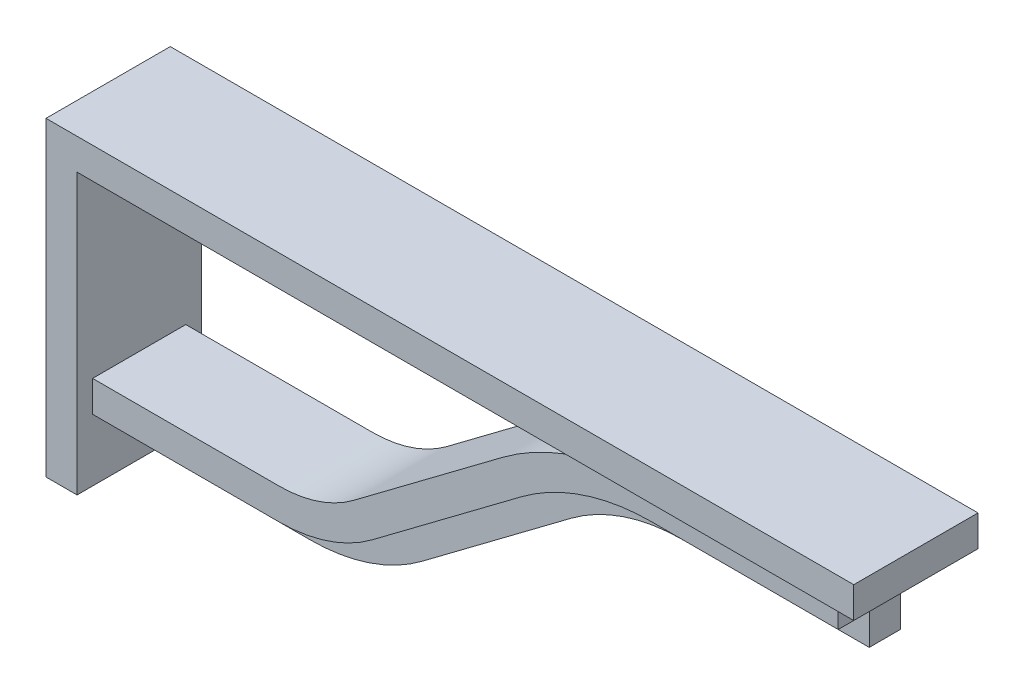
SolidWorks part; units mm, degrees
ref_plane "Front Plane" through (0, 0, 0) normal (0, 0, 1) x (1, 0, 0)
ref_plane "Top Plane" through (0, 0, 0) normal (0, 1, 0) x (1, 0, 0)
ref_plane "Right Plane" through (0, 0, 0) normal (1, 0, 0) x (0, 0, -1)
sketch "Sketch1" plane through (0, 0, 0) normal (0, 0, 1) x (1, 0, 0)
  line L0 (0, 0) -> (-76.2, 0)
  line L1 (-121.92, -15.24) -> (-182.88, -60.96)
  line L2 (-228.6, -76.2) -> (-304.8, -76.2)
  arc A0 (-76.2, 0) -> (-121.92, -15.24) centre (-76.2, -76.2) ccw
  arc A1 (-182.88, -60.96) -> (-228.6, -76.2) centre (-228.6, 0) cw
  dimension "D2" = 76.2
  dimension "D1" = 76.2
  dimension "D3" = 304.8
  dimension "D4" = 76.2
  dimension "D5" = 76.2
sketch "Sketch2" plane through (0, 0, 0) normal (1, 0, 0) x (0, 0, -1)
  line L0 (0, 0) -> (0, 32.8394) construction
  line L1 (-6.35, 0) -> (6.35, 0)
  line L2 (6.35, 0) -> (6.35, 12.7)
  line L3 (6.35, 12.7) -> (19.05, 12.7)
  line L4 (19.05, 12.7) -> (19.05, 25.4)
  line L5 (19.05, 25.4) -> (-19.05, 25.4)
  line L6 (-19.05, 25.4) -> (-19.05, 12.7)
  line L7 (-19.05, 12.7) -> (-6.35, 12.7)
  line L8 (-6.35, 12.7) -> (-6.35, 0)
  dimension "D1" = 38.1
  dimension "D2" = 12.7
  dimension "D3" = 25.4
  dimension "D4" = 12.7
sweep "Sweep1" add profiles "Sketch2" path "Sketch1"
sketch "Sketch3" plane through (0, 0, 0) normal (0, 0, 1) x (1, 0, 0)
  line L0 (12.7, 25.4) -> (-304.8, 25.4)
  line L1 (-304.8, 25.4) -> (-304.8, -88.9)
  line L2 (-304.8, -88.9) -> (-317.5, -88.9)
  line L3 (-317.5, -88.9) -> (-317.5, 38.1)
  line L4 (-317.5, 38.1) -> (12.7, 38.1)
  line L5 (12.7, 38.1) -> (12.7, 25.4)
  line L8 (-304.8, -50.8) -> (-304.8, -63.5) construction
  dimension "D1" = 12.7
  dimension "D2" = 12.7
  dimension "D3" = 127
  dimension "D5" = 330.2
extrude "Boss-Extrude1" add sketch "Sketch3" along normal mid plane 50.8
